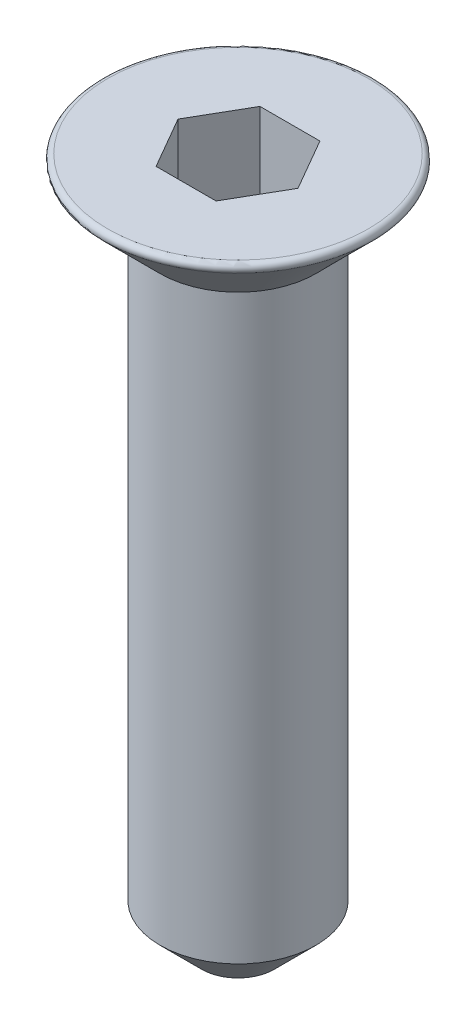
SolidWorks part; units mm, degrees
ref_plane "Plan de face" through (0, 0, 0) normal (0, 0, 1) x (1, 0, 0)
ref_plane "Plan de dessus" through (0, 0, 0) normal (0, 1, 0) x (1, 0, 0)
ref_plane "Plan de droite" through (0, 0, 0) normal (1, 0, 0) x (0, 0, -1)
sketch "Esquisse1" plane through (0, 0, 0) normal (0, 0, 1) x (1, 0, 0)
  line L0 (0, 15.488) -> (0, -29.9279) construction
  line L1 (0, 0) -> (-2.75, 0)
  line L2 (-2.75, 0) -> (-1.5, -1.25)
  line L3 (-1.5, -1.25) -> (-1.5, -13.25)
  line L4 (-1.5, -13.25) -> (0, -13.25)
  line L5 (0, 0) -> (0, -13.25)
  dimension "D1" = 2.75
  dimension "D2" = 1.5
  dimension "D3" = 45
  dimension "D4" = 12
revolve "Révolution1" add sketch "Esquisse1" angle 360 about L0
fillet "Congé1" radius 0.1 1 edges at (0, 0, 2.75)
chamfer "Chanfrein1" distance 0.8 angle 45 1 edges at (0, -13.25, 1.5)
sketch "Esquisse2" plane through (0, 0, 0) normal (0, 1, 0) x (1, 0, 0)
  line L1 (1.1547, 0) -> (0.5774, 1)
  line L2 (0.5774, 1) -> (-0.5774, 1)
  line L3 (-0.5774, 1) -> (-1.1547, 0)
  line L4 (-1.1547, 0) -> (-0.5774, -1)
  line L5 (-0.5774, -1) -> (0.5774, -1)
  line L6 (0.5774, -1) -> (1.1547, 0)
  circle A0 centre (0, 0) radius 1 construction
  dimension "D1" = 2
extrude "Enlèv. mat.-Extru.1" cut sketch "Esquisse2" against normal blind 3
